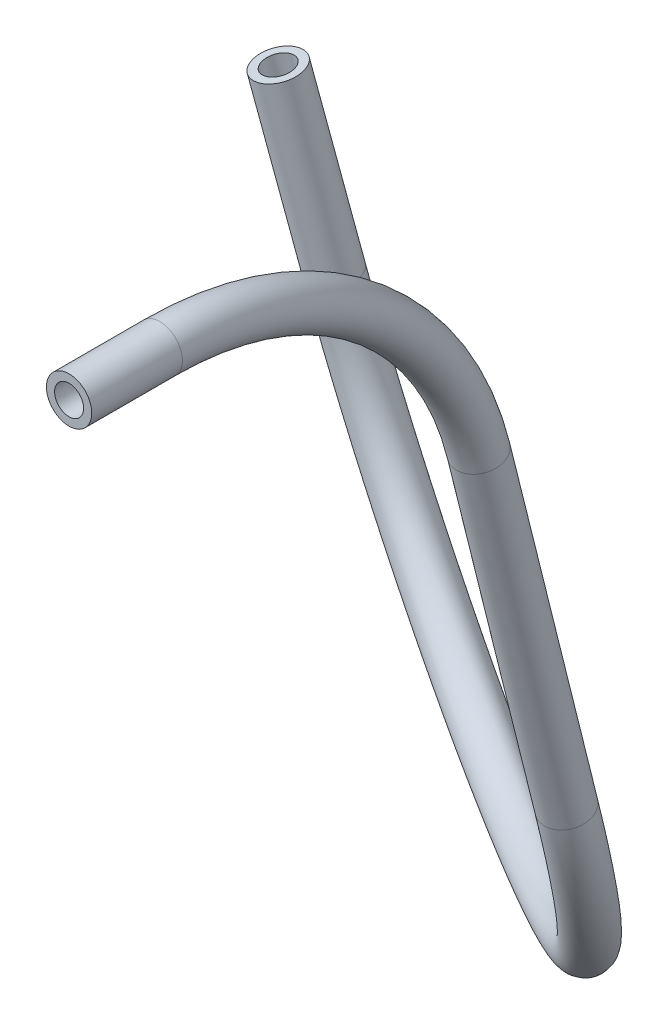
SolidWorks part; units mm, degrees
ref_plane "Front Plane" through (0, 0, 0) normal (0, 0, 1) x (1, 0, 0)
ref_plane "Top Plane" through (0, 0, 0) normal (0, 1, 0) x (1, 0, 0)
ref_plane "Right Plane" through (0, 0, 0) normal (1, 0, 0) x (0, 0, -1)
sketch "Sketch1" plane through (0, 0, 0) normal (1, 0, 0) x (0, 0, -1)
  line L3 (28.685, -17.45) -> (34.8298, -42.0955)
  line L4 (6.35, 0) -> (0, 0)
  arc A2 (28.685, -17.45) -> (6.35, 0) centre (6.35, -23.0187) ccw
  dimension "D1" = 23.0187
  dimension "D2" = 104
  dimension "D5" = 25.4
  dimension "D7" = 6.35
sketch "Sketch2" plane through (0, 0, 0) normal (0, 0, 1) x (1, 0, 0)
  circle A0 centre (0, 0) radius 1.5875
  circle A1 centre (0, 0) radius 1.016
  dimension "D1" = 3.175
  dimension "D2" = 2.032
sweep "Sweep2" add profiles "Sketch2" path "Sketch1"
ref_plane "Plane2" through (0, 5.7121, -22.91) normal (0, 0.2419, -0.9703) x (-0.9703, -0.2347, -0.0585)
sketch "Sketch5" plane through (0, -47.8076, -11.9198) normal (0, -0.9703, -0.2419) x (1, 0, 0)
  line L0 (-23.7419, -28.3522) -> (-11.5024, -49.5515) construction
  line L1 (0, -23.6114) -> (0, -13.3682) construction
  circle A0 centre (0, -23.6114) radius 1.016
  circle A1 centre (0, -23.6114) radius 1.5875
  dimension "D1" = 30
  dimension "D2" = 22.9314
revolve "Revolve1" add sketch "Sketch5" angle 169 about L0
sketch "Sketch6" plane through (6.897, -40.7173, -6.0481) normal (-0.1652, 0.9755, 0.1449) x (0.2013, -0.1105, 0.9733)
  circle A0 centre (-59.7969, -35.435) radius 1.016 construction
  circle A1 centre (-59.7969, -35.435) radius 1.5875
  circle A2 centre (-59.7969, -35.435) radius 1.5875
  circle A3 centre (-59.7969, -35.435) radius 1.016
  dimension "D1" = 0
extrude "Boss-Extrude1" add sketch "Sketch6" along normal blind 12.7
equation "\"Buoyancy\"=\"SW-Volume\"*(\"SW-Density\"-.037062)"
